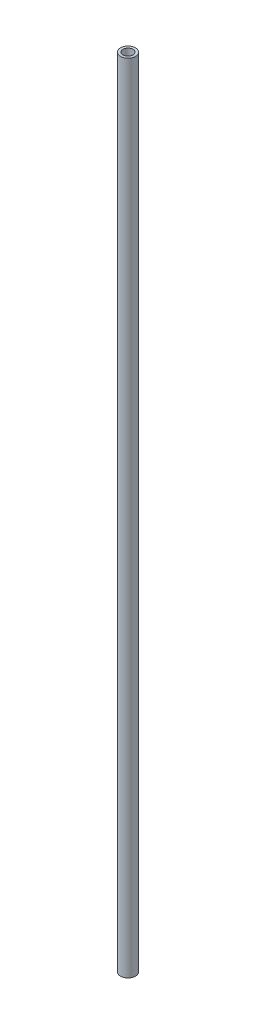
SolidWorks part; units mm, degrees
ref_plane "Front" through (0, 0, 0) normal (0, 0, 1) x (1, 0, 0)
ref_plane "Top" through (0, 0, 0) normal (0, 1, 0) x (1, 0, 0)
ref_plane "Right" through (0, 0, 0) normal (1, 0, 0) x (0, 0, -1)
sketch "草图1" plane through (0, 0, 0) normal (0, 1, 0) x (1, 0, 0)
  circle A0 centre (0, 0) radius 1.5
  circle A1 centre (0, 0) radius 1
  dimension "D1" = 3
  dimension "D2" = 2
extrude "凸台-拉伸1" add sketch "草图1" along normal blind 160
